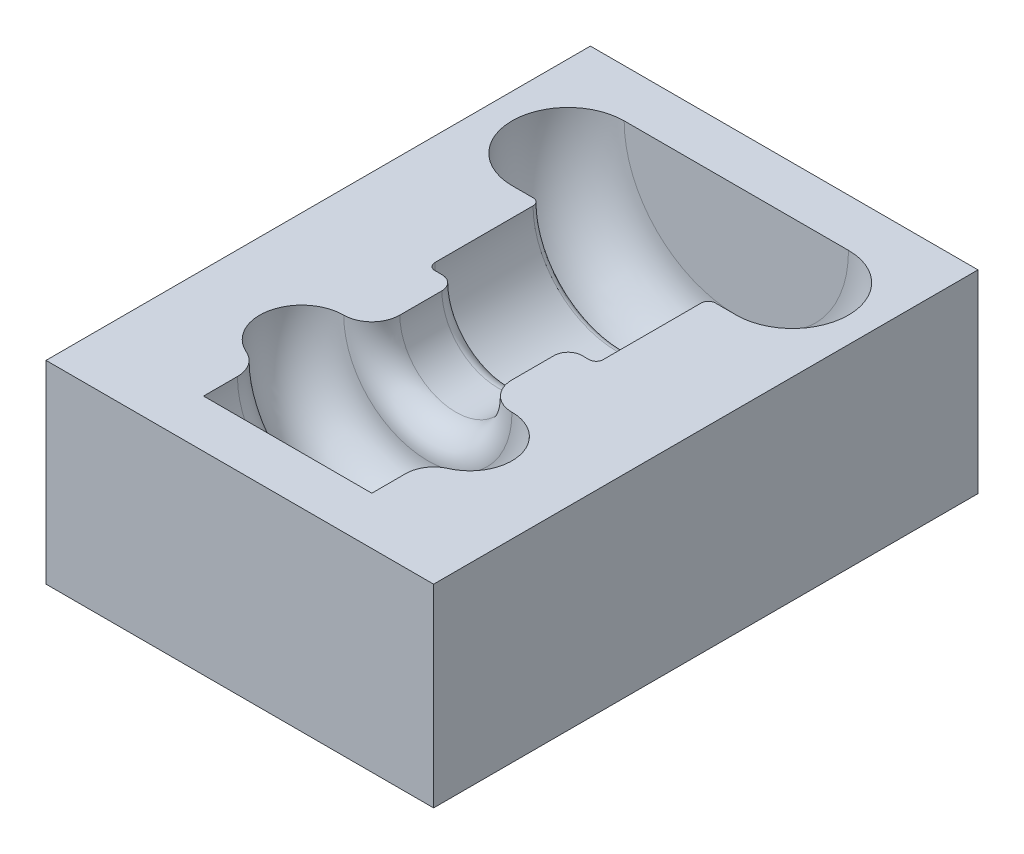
SolidWorks part; units mm, degrees
ref_plane "Front Plane" through (0, 0, 0) normal (0, 0, 1) x (1, 0, 0)
ref_plane "Top Plane" through (0, 0, 0) normal (0, 1, 0) x (1, 0, 0)
ref_plane "Right Plane" through (0, 0, 0) normal (1, 0, 0) x (0, 0, -1)
inserted part "Mold Base<1>@Interim Assembly"
sketch "Sketch1" plane through (0, 0, 100) normal (0, 0, 1) x (1, 0, 0)
  line L0 (-71.2, 0) -> (71.2, 0)
  line L1 (-71.2, 71.2) -> (-71.2, -71.2) construction
  line L2 (71.2, -71.2) -> (71.2, 71.2) construction
split "Split1" trim tools "Sketch1" bodies to split 103 resulting bodies 104
